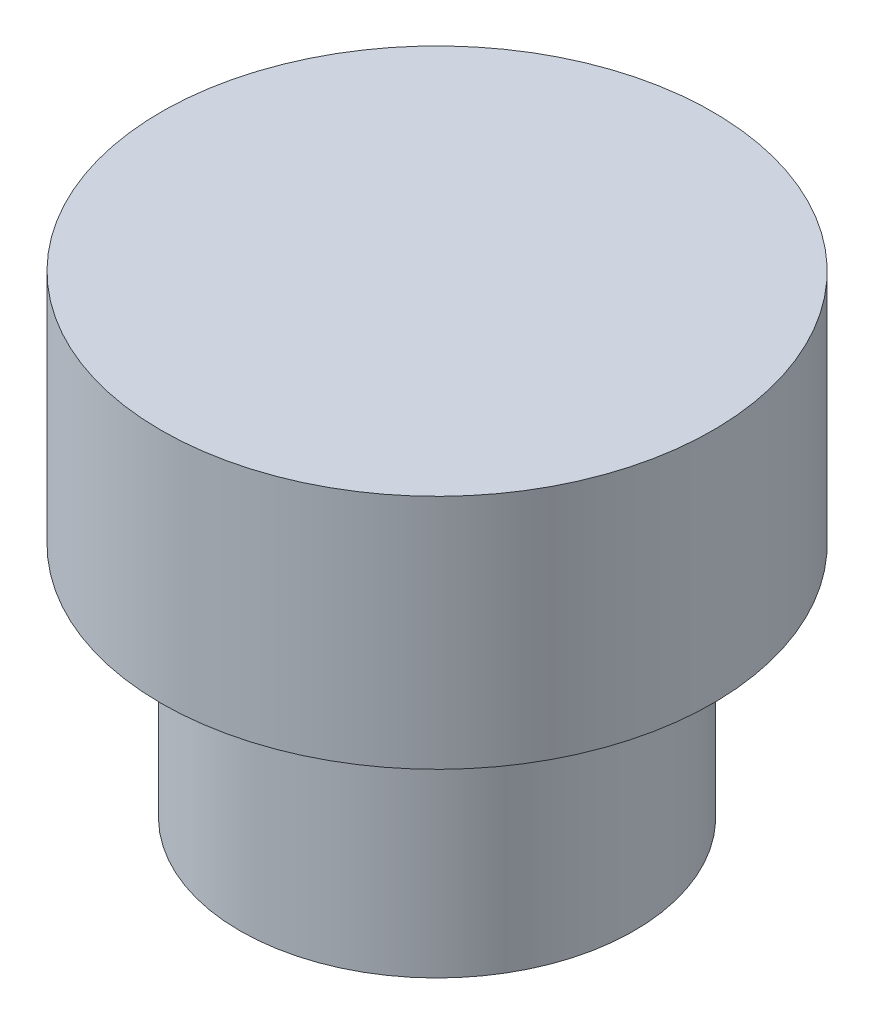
SolidWorks part; units mm, degrees
ref_plane "Plan1" through (0, 0, 0) normal (0, 0, 1) x (1, 0, 0)
ref_plane "Plan2" through (0, 0, 0) normal (0, 1, 0) x (1, 0, 0)
ref_plane "Plan3" through (0, 0, 0) normal (1, 0, 0) x (0, 0, -1)
sketch "Esquisse1" plane through (0, 0, 0) normal (0, 1, 0) x (1, 0, 0)
  circle A0 centre (0, 0) radius 1.75
  dimension "D1" = 3.5
extrude "Base-Extrusion" add sketch "Esquisse1" along normal blind 1.5
sketch "Esquisse2" plane through (0, 0, 0) normal (0, -1, 0) x (1, 0, 0)
  circle A0 centre (0, 0) radius 1.25 construction
  circle A1 centre (0, 0) radius 1.25
extrude "Boss.-Extru.1" add sketch "Esquisse2" along normal up to surface (1.5 mm away)
